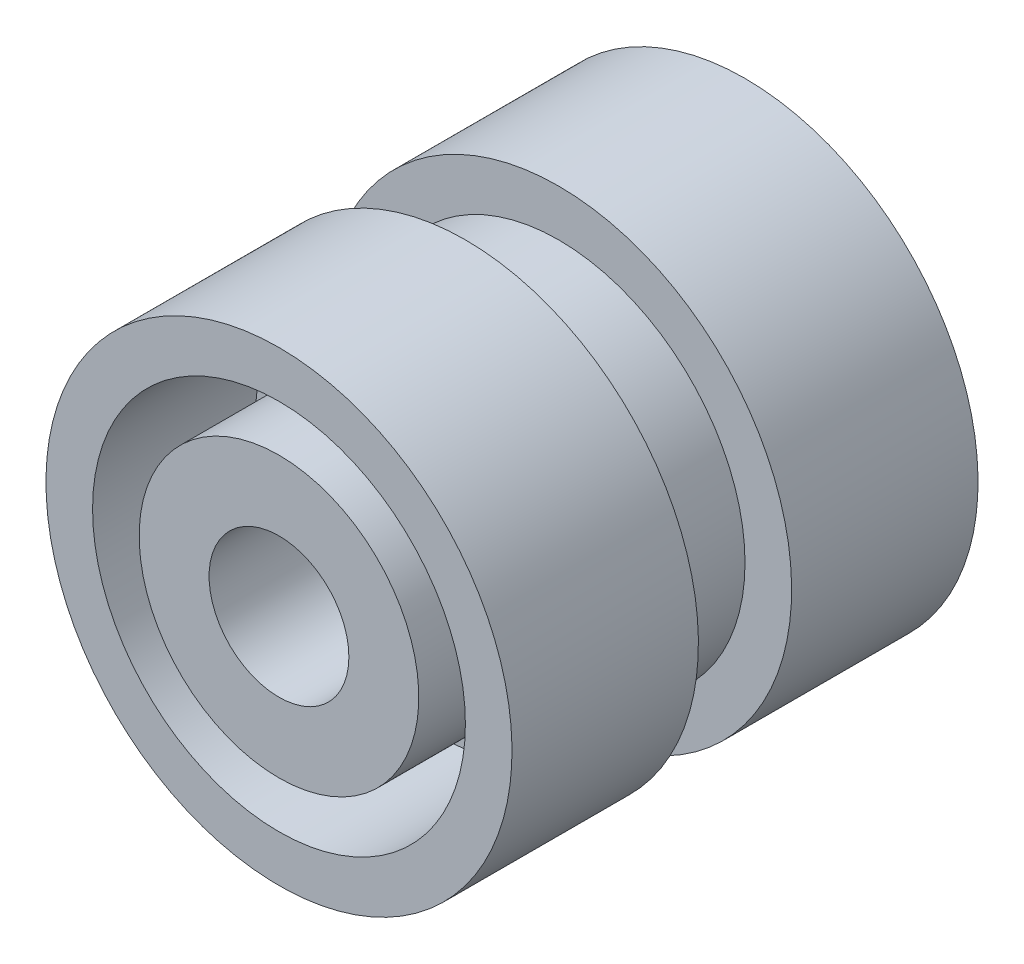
SolidWorks part; units mm, degrees
ref_plane "Front Plane" through (0, 0, 0) normal (0, 0, 1) x (1, 0, 0)
ref_plane "Top Plane" through (0, 0, 0) normal (0, 1, 0) x (1, 0, 0)
ref_plane "Right Plane" through (0, 0, 0) normal (1, 0, 0) x (0, 0, -1)
sketch "Croquis1" plane through (0, 0, 0) normal (1, 0, 0) x (0, 0, -1)
  line L0 (0, 0) -> (-5, 0)
  line L1 (-5, 0) -> (-5, 3)
  line L2 (-5, 3) -> (-1.5, 3)
  line L3 (-1.5, 3) -> (-1.5, 4)
  line L4 (-1.5, 4) -> (-5, 4)
  line L5 (-5, 4) -> (-5, 5)
  line L6 (-5, 5) -> (-1, 5)
  line L7 (-1, 5) -> (-1, 4)
  line L8 (0, 0) -> (0, 7.131) construction
  line L9 (-1, 4) -> (1, 4)
  line L10 (1, 5) -> (1, 4)
  line L11 (5, 5) -> (1, 5)
  line L12 (5, 4) -> (5, 5)
  line L13 (1.5, 4) -> (5, 4)
  line L14 (1.5, 4) -> (1.5, 0)
  line L15 (1.5, 0) -> (0, 0)
  point P13 (0, 4)
  dimension "D1" = 5
  dimension "D2" = 3
  dimension "D3" = 3.5
  dimension "D4" = 1
  dimension "D5" = 1
  dimension "D6" = 1
  dimension "D7" = 1
revolve "Revolución1" add sketch "Croquis1" angle 360 about L0
sketch "Croquis2" plane through (0, 0, -1.5) normal (0, 0, -1) x (-1, 0, 0)
  line L0 (0, 2) -> (0, 4) construction
  line L1 (0.5, 1.9365) -> (0.5, 3.9686)
  line L2 (-0.5, 1.9365) -> (-0.5, 3.9686)
  line L3 (-0.5, 0) -> (-0.5, 4) construction
  line L4 (0.5, 0) -> (0.5, 4) construction
  line L5 (0, 0) -> (0, 4) construction
  line L6 (1.9365, 0.5) -> (3.9686, 0.5)
  line L7 (1.9365, -0.5) -> (3.9686, -0.5)
  line L8 (0.5, -1.9365) -> (0.5, -3.9686)
  line L9 (-0.5, -1.9365) -> (-0.5, -3.9686)
  line L10 (-1.9365, -0.5) -> (-3.9686, -0.5)
  line L11 (-1.9365, 0.5) -> (-3.9686, 0.5)
  arc A0 (-0.5, 1.9365) -> (-1.9365, 0.5) centre (0, 0) ccw
  arc A1 (-3.9686, 0.5) -> (-3.9686, -0.5) centre (0, 0) ccw
  arc A2 (1.9365, 0.5) -> (0.5, 1.9365) centre (0, 0) ccw
  arc A3 (0.5, -1.9365) -> (1.9365, -0.5) centre (0, 0) ccw
  arc A4 (-1.9365, -0.5) -> (-0.5, -1.9365) centre (0, 0) ccw
  arc A5 (-1.9365, -0.5) -> (-0.5, -1.9365) centre (0, 0) ccw
  arc A6 (-1.9365, -0.5) -> (-0.5, -1.9365) centre (0, 0) ccw
  arc A7 (-1.9365, -0.5) -> (-0.5, -1.9365) centre (0, 0) ccw
  arc A8 (1.9365, 0.5) -> (0.5, 1.9365) centre (0, 0) ccw
  arc A9 (1.9365, 0.5) -> (0.5, 1.9365) centre (0, 0) ccw
  arc A10 (1.9365, 0.5) -> (0.5, 1.9365) centre (0, 0) ccw
  arc A11 (0.5, -1.9365) -> (1.9365, -0.5) centre (0, 0) ccw
  arc A12 (0.5, -1.9365) -> (1.9365, -0.5) centre (0, 0) ccw
  arc A13 (0.5, -1.9365) -> (1.9365, -0.5) centre (0, 0) ccw
  arc A14 (-0.5, -3.9686) -> (0.5, -3.9686) centre (0, 0) ccw
  arc A15 (3.9686, -0.5) -> (3.9686, 0.5) centre (0, 0) ccw
  arc A16 (0.5, 3.9686) -> (-0.5, 3.9686) centre (0, 0) ccw
  arc A17 (-0.5, 1.9365) -> (-1.9365, 0.5) centre (0, 0) ccw
  arc A18 (-0.5, 1.9365) -> (-1.9365, 0.5) centre (0, 0) ccw
  arc A19 (-0.5, 1.9365) -> (-1.9365, 0.5) centre (0, 0) ccw
  point P28 (0, 0)
  dimension "D1" = 4
  dimension "D2" = 0.5
  dimension "D3" = 0.5
  dimension "D4" = 4
extrude "Saliente-Extruir1" add sketch "Croquis2" along normal blind 2 contours L10 A4 L9 L8 A3 L7 L6 A2 L1 L2 A0 L11 M1
sketch "Croquis3" plane through (0, 0, 5) normal (0, 0, 1) x (1, 0, 0)
  circle A0 centre (0, 0) radius 1.5
  dimension "D1" = 3
extrude "Cortar-Extruir1" cut sketch "Croquis3" against normal blind 8
